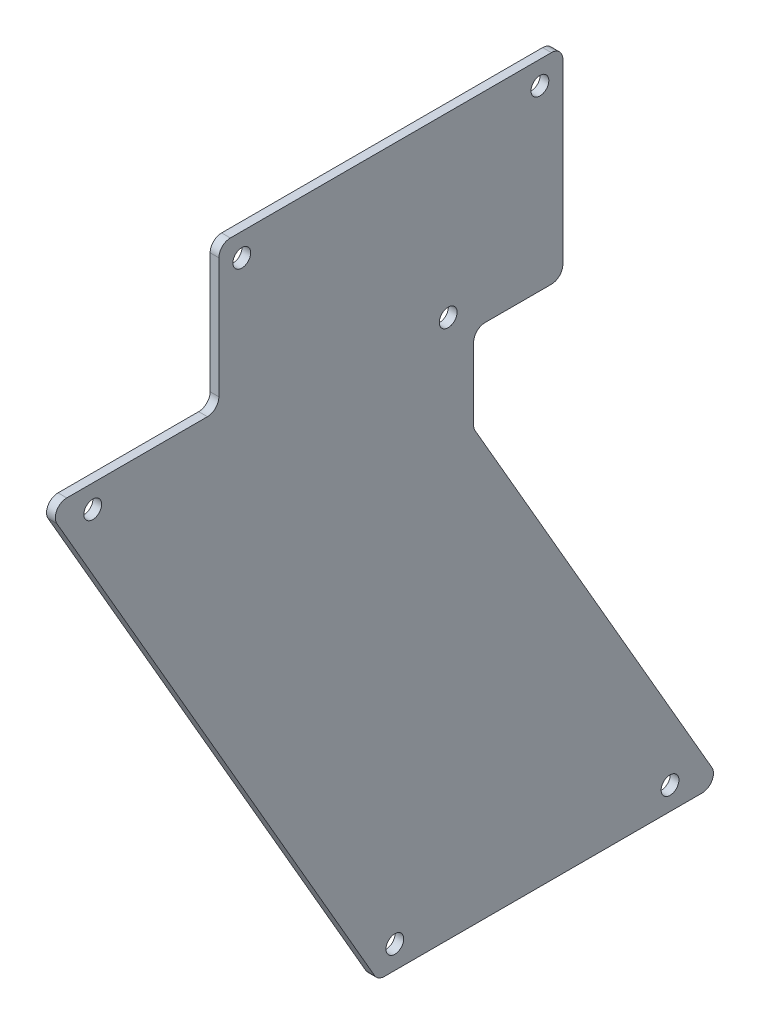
SolidWorks part; units mm, degrees
ref_plane "Front Plane" through (0, 0, 0) normal (0, 0, 1) x (1, 0, 0)
ref_plane "Top Plane" through (0, 0, 0) normal (0, 1, 0) x (1, 0, 0)
ref_plane "Right Plane" through (0, 0, 0) normal (1, 0, 0) x (0, 0, -1)
sketch "Sketch1" plane through (0, 0, 0) normal (1, 0, 0) x (0, 0, -1)
  line L0 (0, 0) -> (40, 0)
  line L1 (40, 0) -> (-3.3013, 75)
  line L2 (-3.3013, 75) -> (-3.3013, 90)
  line L3 (-3.3013, 90) -> (12.265, 90)
  line L4 (12.265, 90) -> (12.265, 125)
  line L5 (12.265, 125) -> (-47.735, 125)
  line L6 (-47.735, 125) -> (-47.735, 100)
  line L7 (-47.735, 100) -> (-77.735, 100)
  line L8 (-77.735, 100) -> (-20, 0)
  line L9 (-20, 0) -> (0, 0)
  dimension "D1" = 60
  dimension "D2" = 40
  dimension "D3" = 20
  dimension "D4" = 90
  dimension "D5" = 15
  dimension "D6" = 35
  dimension "D7" = 60
  dimension "D8" = 120
  dimension "D9" = 25
  dimension "D10" = 30
extrude "Boss-Extrude1" add sketch "Sketch1" along normal blind 1.524
hole_wizard "Ø3.1 (3.1) Diameter Hole1" positions "Sketch3" profile "Sketch2" hole size "Ø3.1" standard "ANSI Metric"
sketch "Sketch3" plane through (1.524, 0, 0) normal (1, 0, 0) x (0, 0, -1)
  line L0 (-43.735, 121) -> (8.265, 121) construction
  line L2 (-17.04, 4) -> (30.96, 4) construction
  line L4 (12.265, 125) -> (-47.735, 125) construction
  line L5 (12.265, 90) -> (12.265, 125) construction
  line L6 (-47.735, 125) -> (-47.735, 100) construction
  line L7 (-47.735, 100) -> (-77.735, 100) construction
  line L8 (-20, 0) -> (40, 0) construction
  line L9 (-3.3013, 90) -> (12.265, 90) construction
  point P0 (-43.735, 121)
  point P2 (8.265, 121)
  point P4 (-69.735, 96)
  point P6 (-17.04, 4)
  point P8 (30.96, 4)
  point P10 (-7.735, 94)
  dimension "D1" = 4
  dimension "D2" = 4
  dimension "D3" = 4
  dimension "D4" = 4
  dimension "D5" = 8
  dimension "D6" = 4
  dimension "D7" = 2.96
  dimension "D8" = 48
  dimension "D9" = 4
  dimension "D10" = 62
sketch "Sketch2" plane through (1.524, 121, 43.735) normal (0, 1, 0) x (0, 0, -1)
  line L0 (0, 0) -> (0, 1.524)
  line L1 (0, 1.524) -> (1.55, 1.524)
  line L2 (1.55, 1.524) -> (1.55, 0)
  line L5 (1.55, 0) -> (0, 0)
  line L11 (0, -6.35) -> (0, 107.95) construction
  dimension "Thru Hole Dia." = 3.1
  dimension "Thru Hole Depth" = 1.524
fillet "Fillet1" radius 2 9 edges at (0.762, 0, -40) (0.762, 0, 20) (0.762, 75, 3.3013) (0.762, 90, 3.3013) (0.762, 90, -12.265) (0.762, 125, -12.265) (0.762, 125, 47.735) (0.762, 100, 47.735) (0.762, 100, 77.735)
